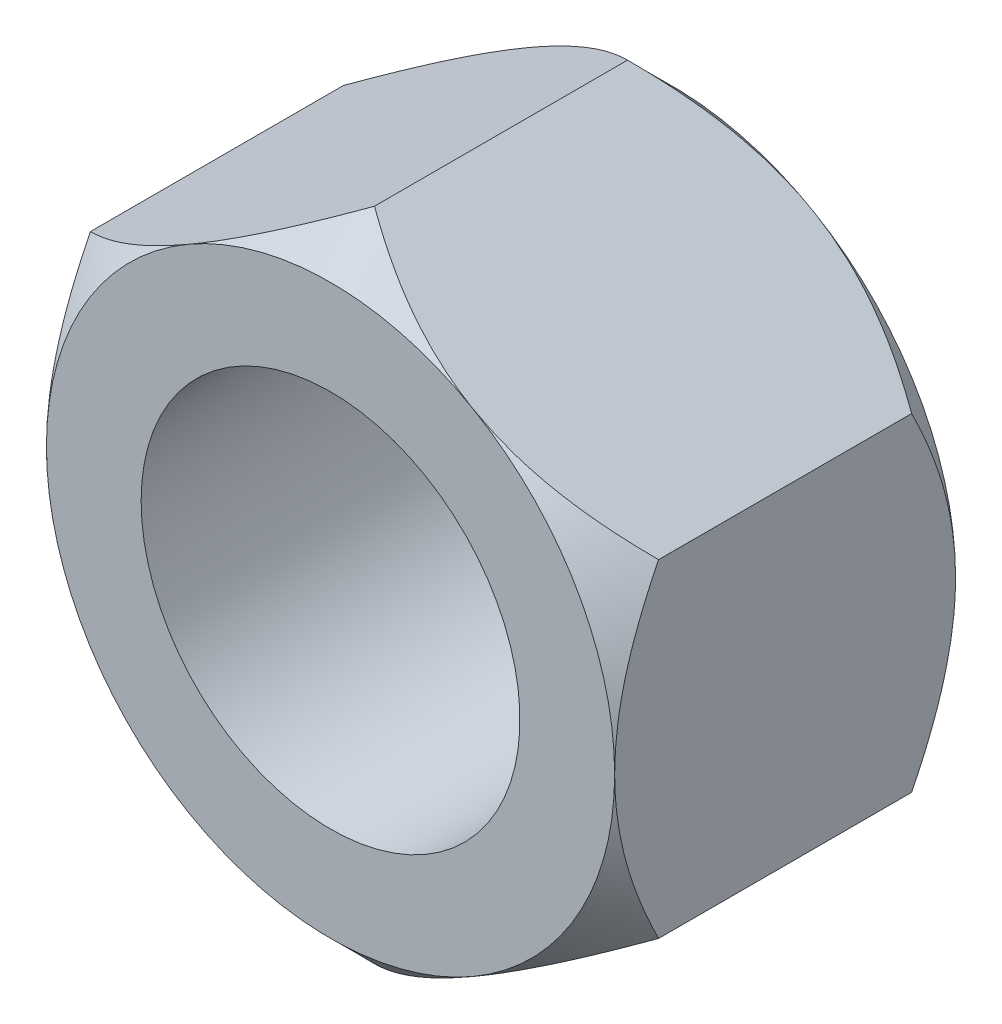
SolidWorks part; units mm, degrees
ref_plane "Plan1" through (0, 0, 0) normal (0, 0, 1) x (1, 0, 0)
ref_plane "Plan2" through (0, 0, 0) normal (0, 1, 0) x (1, 0, 0)
ref_plane "Plan3" through (0, 0, 0) normal (1, 0, 0) x (0, 0, -1)
sketch "E_corps" plane through (0, 0, 0) normal (0, 0, 1) x (1, 0, 0)
  line L0 (0, 91.6337) -> (0, -97.1696) construction
  line L1 (0, 10.3923) -> (9, 5.1962)
  line L2 (0, 10.3923) -> (-9, 5.1962)
  line L3 (9, 5.1962) -> (9, -5.1962)
  line L4 (-9, 5.1962) -> (-9, -5.1962)
  line L5 (9, -5.1962) -> (0, -10.3923)
  line L6 (-9, -5.1962) -> (0, -10.3923)
  circle A0 centre (0, 0) radius 10.3923 construction
  dimension "a" = 18
extrude "Corps" add sketch "E_corps" along normal blind 10.8
sketch "E_chanfrein" plane through (0, 0, 10.8) normal (0, 0, 1) x (1, 0, 0)
  line L0 (9, 5.1962) -> (9, -5.1962) construction
  circle A0 centre (0, 0) radius 9
extrude "Chanfrein" cut sketch "E_chanfrein" against normal through all draft 45 flip side to cut
ref_plane "Plan_de_symétrie" through (0, 0, 5.4) normal (0, 0, 1) x (1, 0, 0)
mirror "Symétrie" about plane through (0, 0, 5.4) normal (0, 0, 1) of "Chanfrein"
sketch "E_perçage" plane through (0, 0, 0) normal (0, 0, -1) x (-1, 0, 0)
  circle A0 centre (0, 0) radius 6
  dimension "Diamètre_nominale" = 12
extrude "Perçage_diamètre_nominal" cut sketch "E_perçage" against normal through all
equation "\"D1@Plan_de_symétrie\" = 0.5*\"Hauteur@Corps\""
